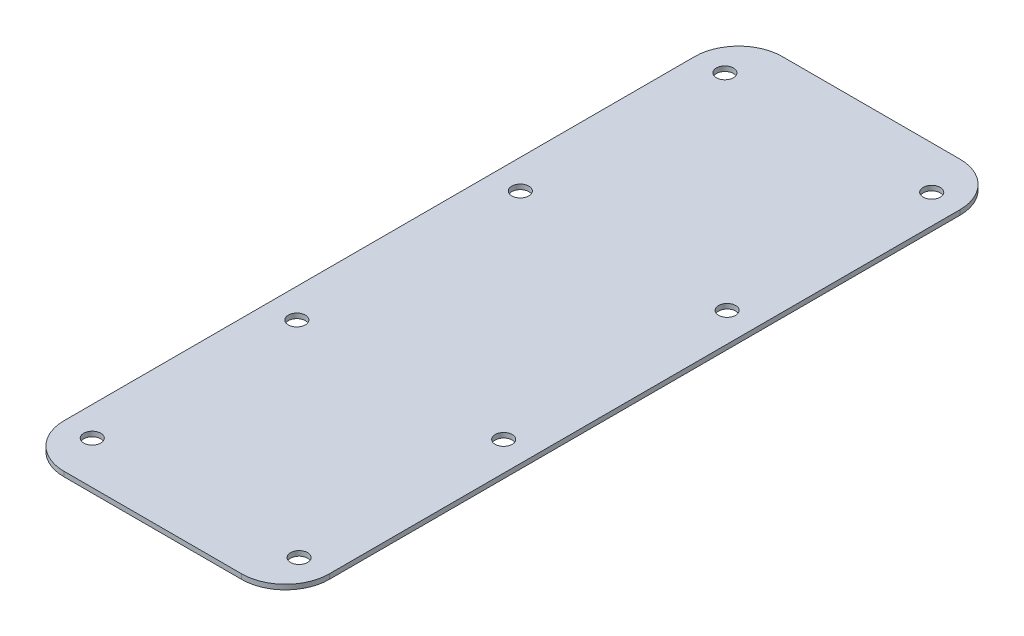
SolidWorks part; units mm, degrees
ref_plane "Front Plane" through (0, 0, 0) normal (0, 0, 1) x (1, 0, 0)
ref_plane "Top Plane" through (0, 0, 0) normal (0, 1, 0) x (1, 0, 0)
ref_plane "Right Plane" through (0, 0, 0) normal (1, 0, 0) x (0, 0, -1)
sketch "sk w14x665"
  line L0 (-224.155, 274.828) -> (224.155, -274.828) construction
  point P1 (35.941, 0)
sketch_block_instance "W14x665-1"
sketch_block "W14x665" parameters "D6"=15.24, "D1"=71.882, "D2"=448.31, "D3"=549.656, "D4"=114.808, "D5"=114.808, "D7"=35.941
ref_plane "midplane" through (0, 44.45, 0) normal (0, 1, 0) x (1, 0, 0)
sketch "clearance" plane through (0, 44.45, 0) normal (0, 1, 0) x (1, 0, 0)
  line L6 (-224.155, 274.828) -> (224.155, 274.828) construction
  line L7 (-224.155, 160.02) -> (-224.155, 274.828) construction
  line L8 (-51.181, 160.02) -> (-224.155, 160.02) construction
  line L9 (-35.941, -144.78) -> (-35.941, 144.78) construction
  line L10 (35.941, 144.78) -> (35.941, -144.78) construction
  line L12 (224.155, 274.828) -> (224.155, 160.02) construction
  line L13 (51.181, -160.02) -> (224.155, -160.02) construction
  line L14 (224.155, -274.828) -> (-224.155, -274.828) construction
  line L68 (-229.235, 271.5441) -> (-220.8711, 279.908)
  line L69 (-220.8711, 279.908) -> (220.8711, 279.908)
  line L70 (220.8711, 279.908) -> (229.235, 271.5441)
  line L71 (229.235, 271.5441) -> (229.235, 163.3039)
  line L72 (229.235, 163.3039) -> (220.8711, 154.94)
  line L73 (220.8711, 154.94) -> (50.0013, 154.94)
  line L74 (50.0013, 154.94) -> (41.021, 145.9597)
  line L75 (41.021, 145.9597) -> (41.021, -145.9597)
  line L76 (41.021, -145.9597) -> (50.0013, -154.94)
  line L77 (50.0013, -154.94) -> (220.8711, -154.94)
  line L78 (220.8711, -154.94) -> (229.235, -163.3039)
  line L79 (229.235, -163.3039) -> (229.235, -271.5441)
  line L80 (229.235, -271.5441) -> (220.8711, -279.908)
  line L81 (220.8711, -279.908) -> (-220.8711, -279.908)
  line L82 (-220.8711, -279.908) -> (-229.235, -271.5441)
  line L83 (-229.235, -271.5441) -> (-229.235, -163.3039)
  line L84 (-229.235, -163.3039) -> (-220.8711, -154.94)
  line L85 (-220.8711, -154.94) -> (-50.0013, -154.94)
  line L86 (-50.0013, -154.94) -> (-41.021, -145.9597)
  line L87 (-41.021, -145.9597) -> (-41.021, 145.9597)
  line L88 (-41.021, 145.9597) -> (-50.0013, 154.94)
  line L89 (-50.0013, 154.94) -> (-220.8711, 154.94)
  line L90 (-220.8711, 154.94) -> (-229.235, 163.3039)
  line L91 (-229.235, 163.3039) -> (-229.235, 271.5441)
  dimension "D3" = 1.27
  dimension "D4" = 45
  dimension "D5" = 45
  dimension "D6" = 1.27
  dimension "D7" = 5.08
  dimension "D8" = 1.27
  dimension "D9" = 5.08
  dimension "D10" = 5.08
  dimension "D11" = 5.08
  dimension "D12" = 5.08
  dimension "D13" = 1.27
  dimension "D14" = 5.08
  dimension "D15" = 1.27
  dimension "D16" = 5.08
  dimension "D17" = 12.7
  dimension "D18" = 1.27
  dimension "D19" = 5.08
  dimension "D20" = 12.7
  dimension "D21" = 12.7
  dimension "D22" = 12.7
  dimension "D23" = 1.27
  dimension "D24" = 1.27
sketch "bolt plate boundary"
  line L7 (224.155, -274.828) -> (241.3488, -295.9087)
  line L8 (-220.8711, 279.908) -> (220.8711, 279.908) construction
  line L9 (-224.155, 274.828) -> (224.155, -274.828) construction
  line L10 (-41.021, -145.9597) -> (-41.021, 145.9597) construction
  line L11 (-224.155, 274.828) -> (-241.3488, 295.9087)
  line L12 (41.021, 145.9597) -> (41.021, -145.9597) construction
  line L15 (220.8711, -279.908) -> (-220.8711, -279.908) construction
  point P15 (0, -305.5874)
  point P16 (-66.7004, 0)
  point P17 (-308.3103, 362.8701)
  point P18 (-308.3103, 362.8701)
  point P19 (66.7004, 0)
  dimension "D1" = 27.2034
  dimension "D2" = 25.6794
  dimension "D3" = 25.6794
  dimension "D4" = 25.6794
  dimension "D5" = 25.6794
  dimension "D6" = 27.2034
sketch_block_instance "3.5in bolt-3"
sketch_block "3.5in bolt" parameters "D1"=88.9, "D2"=136.525, "D3"=6.35, "D4"=40.7227, "D5"=45, "D6"=9.525
sketch_block_instance "3.5in bolt-4"
sketch_block_instance "3.5in bolt-5"
sketch_block_instance "3.5in bolt-6"
sketch_block_instance "3.5in bolt-7"
sketch_block_instance "3.5in bolt-8"
sketch "Sketch4" plane through (0, 0, 0) normal (0, 1, 0) x (1, 0, 0)
  line L1 (-403.008, 1612.1596) -> (403.008, 1612.1596)
  line L2 (-403.008, 1612.1596) -> (-403.008, -494.9829)
  line L3 (-403.008, -494.9829) -> (403.008, -494.9829)
  line L4 (403.008, 1612.1596) -> (403.008, -494.9829)
  circle A0 centre (308.3103, -362.8701) radius 94.6977 construction
  circle A3 centre (-308.3103, 362.8701) radius 94.6977 construction
  circle A4 centre (0, -400.2851) radius 94.6977 construction
  dimension "D1" = 1612.1596
extrude "main plate" add sketch "Sketch4" along normal blind 12.7
sketch "sk bolt holes"
  line L0 (-308.3103, 1480.0468) -> (-308.3103, 754.3065) construction
  dimension "D1" = 1117.1767
sketch_block_instance "Block1-1"
sketch_block "Block1" parameters "D1"=92.075, "D2"=92.075, "D3"=92.075, "D4"=92.075, "D5"=92.075, "D6"=92.075, "D7"=92.075, "D8"=92.075, "D9"=152.4
sketch_block_instance "Block1-2"
extrude "Cut-Extrude2" [suppressed] cut sketch "sk bolt holes" along normal blind 88.9
fillet "Fillet1" radius 139.7 4 edges at (-403.008, 6.35, -1612.1596) (403.008, 6.35, -1612.1596) (403.008, 6.35, 494.9829) (-403.008, 6.35, 494.9829)
sketch "Sketch5" plane through (0, 0, 0) normal (0, 1, 0) x (1, 0, 0)
  line L0 (-263.308, 494.9829) -> (263.308, 494.9829)
  line L1 (403.008, 355.2829) -> (403.008, 178.1629) construction
  line L2 (-403.008, 355.2829) -> (-403.008, 178.1629) construction
  line L3 (-403.008, -494.9829) -> (403.008, -494.9829) construction
  line L4 (-403.008, 1612.1596) -> (-403.008, -494.9829) construction
  line L5 (403.008, 1612.1596) -> (403.008, -494.9829) construction
  line L6 (-622.6455, 355.2829) -> (-403.008, 355.2829)
  line L7 (-622.6455, 355.2829) -> (-622.6455, 1883.2722)
  line L8 (-622.6455, 1883.2722) -> (635.7396, 1883.2722)
  line L9 (635.7396, 1883.2722) -> (635.7396, 355.2829)
  line L10 (403.008, 355.2829) -> (635.7396, 355.2829)
  arc A0 (263.308, 494.9829) -> (403.008, 355.2829) centre (263.308, 355.2829) cw
  arc A1 (-263.308, 494.9829) -> (-403.008, 355.2829) centre (-263.308, 355.2829) ccw
  dimension "D2" = 139.7
  dimension "D1" = 989.9658
extrude "Cut-Extrude3" [suppressed] cut sketch "Sketch5" along normal blind 25.4
sketch "edge cut"
  dimension "D3" = 314.108
  dimension "D1" = 314.108
  dimension "D2" = 368.6679
sketch_block_instance "Block2-1"
sketch_block "Block2" parameters "D1"=63.5, "D2"=88.9, "D3"=88.9, "D4"=63.5, "D5"=36.2949, "D6"=205.9404, "D7"=205.9404, "D8"=806.016, "D9"=205.9404, "D10"=205.9404, "D11"=36.2949, "D12"=989.9658
sketch "Sketch8"
  line L9 (-403.008, 1472.4596) -> (-403.008, -355.2829) construction
  circle A9 centre (-308.3103, 1480.0468) radius 46.0375 construction
  point P22 (44.45, -494.9829)
  point P25 (-44.45, -494.9829)
  dimension "D1" = 211.947
  dimension "D2" = 88.9
sketch_block_instance "Block3-1"
sketch_block "Block3" parameters "D2"=63.5, "D1"=45
sketch_block_instance "Block3-2"
extrude "Cut-Extrude4" [suppressed] cut sketch "Sketch8" along normal blind 25.4
extrude "Cut-Extrude5" [suppressed] cut sketch "edge cut" along normal blind 25.4
sketch "Sketch9" [suppressed] plane through (0, 0, 0) normal (0, 1, 0) x (1, 0, 0)
  line L13 (-634.2758, 1741.4763) -> (575.9516, 1741.4763)
  line L14 (-634.2758, 1741.4763) -> (-634.2758, -620.6544)
  line L15 (-634.2758, -620.6544) -> (575.9516, -620.6544)
  line L16 (575.9516, 1741.4763) -> (575.9516, -620.6544)
  line L24 (108.1676, -444.8679) -> (314.108, -444.8679)
  line L25 (54.0685, -467.4039) -> (54.286, -467.1863)
  line L26 (-18.1474, -482.2829) -> (18.1474, -482.2829)
  line L27 (-54.286, -467.1863) -> (-54.0685, -467.4039)
  line L28 (-314.108, -444.8679) -> (-108.1676, -444.8679)
  line L29 (-390.308, 1472.4596) -> (-390.308, -355.2829)
  line L30 (390.308, -355.2829) -> (390.308, 1472.4596)
  line L31 (314.108, 1562.0446) -> (108.1676, 1562.0446)
  line L32 (54.286, 1584.363) -> (54.0685, 1584.5806)
  line L33 (18.1474, 1599.4596) -> (-18.1474, 1599.4596)
  line L34 (-54.0685, 1584.5806) -> (-54.286, 1584.363)
  line L35 (-108.1676, 1562.0446) -> (-314.108, 1562.0446)
  line L36 (108.1676, -444.8679) -> (314.108, -444.8679)
  line L37 (54.0685, -467.4039) -> (54.286, -467.1863)
  line L38 (-18.1474, -482.2829) -> (18.1474, -482.2829)
  line L39 (-54.286, -467.1863) -> (-54.0685, -467.4039)
  line L40 (-314.108, -444.8679) -> (-108.1676, -444.8679)
  line L41 (-390.308, 1472.4596) -> (-390.308, -355.2829)
  line L42 (390.308, -355.2829) -> (390.308, 1472.4596)
  line L43 (314.108, 1562.0446) -> (108.1676, 1562.0446)
  line L44 (54.286, 1584.363) -> (54.0685, 1584.5806)
  line L45 (18.1474, 1599.4596) -> (-18.1474, 1599.4596)
  line L46 (-54.0685, 1584.5806) -> (-54.286, 1584.363)
  line L47 (-108.1676, 1562.0446) -> (-314.108, 1562.0446)
  arc A32 (314.108, -444.8679) -> (377.3411, -411.1887) centre (314.108, -368.6679) ccw
  arc A33 (108.1676, -444.8679) -> (54.286, -467.1863) centre (108.1676, -521.0679) ccw
  arc A34 (18.1474, -482.2829) -> (54.0685, -467.4039) centre (18.1474, -431.4829) ccw
  arc A35 (-54.0685, -467.4039) -> (-18.1474, -482.2829) centre (-18.1474, -431.4829) ccw
  arc A36 (-54.286, -467.1863) -> (-108.1676, -444.8679) centre (-108.1676, -521.0679) ccw
  arc A37 (-377.3411, -411.1887) -> (-314.108, -444.8679) centre (-314.108, -368.6679) ccw
  arc A38 (-390.308, -355.2829) -> (-377.3411, -411.1887) centre (-263.308, -355.2829) ccw
  arc A39 (-377.3411, 1528.3653) -> (-390.308, 1472.4596) centre (-263.308, 1472.4596) ccw
  arc A40 (390.308, 1472.4596) -> (377.3411, 1528.3653) centre (263.308, 1472.4596) ccw
  arc A41 (377.3411, -411.1887) -> (390.308, -355.2829) centre (263.308, -355.2829) ccw
  arc A42 (-314.108, 1562.0446) -> (-377.3411, 1528.3653) centre (-314.108, 1485.8446) ccw
  arc A43 (377.3411, 1528.3653) -> (314.108, 1562.0446) centre (314.108, 1485.8446) ccw
  arc A44 (54.286, 1584.363) -> (108.1676, 1562.0446) centre (108.1676, 1638.2446) ccw
  arc A45 (54.0685, 1584.5806) -> (18.1474, 1599.4596) centre (18.1474, 1548.6596) ccw
  arc A46 (-18.1474, 1599.4596) -> (-54.0685, 1584.5806) centre (-18.1474, 1548.6596) ccw
  arc A47 (-108.1676, 1562.0446) -> (-54.286, 1584.363) centre (-108.1676, 1638.2446) ccw
  arc A48 (314.108, -444.8679) -> (377.3411, -411.1887) centre (314.108, -368.6679) ccw
  arc A49 (108.1676, -444.8679) -> (54.286, -467.1863) centre (108.1676, -521.0679) ccw
  arc A50 (18.1474, -482.2829) -> (54.0685, -467.4039) centre (18.1474, -431.4829) ccw
  arc A51 (-54.0685, -467.4039) -> (-18.1474, -482.2829) centre (-18.1474, -431.4829) ccw
  arc A52 (-54.286, -467.1863) -> (-108.1676, -444.8679) centre (-108.1676, -521.0679) ccw
  arc A53 (-377.3411, -411.1887) -> (-314.108, -444.8679) centre (-314.108, -368.6679) ccw
  arc A54 (-390.308, -355.2829) -> (-377.3411, -411.1887) centre (-263.308, -355.2829) ccw
  arc A55 (-377.3411, 1528.3653) -> (-390.308, 1472.4596) centre (-263.308, 1472.4596) ccw
  arc A56 (390.308, 1472.4596) -> (377.3411, 1528.3653) centre (263.308, 1472.4596) ccw
  arc A57 (377.3411, -411.1887) -> (390.308, -355.2829) centre (263.308, -355.2829) ccw
  arc A58 (-314.108, 1562.0446) -> (-377.3411, 1528.3653) centre (-314.108, 1485.8446) ccw
  arc A59 (377.3411, 1528.3653) -> (314.108, 1562.0446) centre (314.108, 1485.8446) ccw
  arc A60 (54.286, 1584.363) -> (108.1676, 1562.0446) centre (108.1676, 1638.2446) ccw
  arc A61 (54.0685, 1584.5806) -> (18.1474, 1599.4596) centre (18.1474, 1548.6596) ccw
  arc A62 (-18.1474, 1599.4596) -> (-54.0685, 1584.5806) centre (-18.1474, 1548.6596) ccw
  arc A63 (-108.1676, 1562.0446) -> (-54.286, 1584.363) centre (-108.1676, 1638.2446) ccw
  dimension "D1" = 12.7
extrude "Cut-Extrude6" [suppressed] cut sketch "Sketch9" along normal blind 12.7
sketch "Sketch10"
  circle A0 centre (-308.3103, 1480.0468) radius 46.0375 construction
  circle A1 centre (308.3103, 1480.0468) radius 46.0375 construction
  circle A2 centre (0, 1517.4618) radius 46.0375 construction
  circle A3 centre (-161.3981, 1117.1767) radius 46.0375 construction
  circle A4 centre (161.3981, 1117.1767) radius 46.0375 construction
  circle A5 centre (-308.3103, 754.3065) radius 46.0375 construction
  circle A6 centre (0, 716.8915) radius 46.0375 construction
  circle A7 centre (308.3103, 754.3065) radius 46.0375 construction
  circle A8 centre (-308.3103, 362.8701) radius 46.0375 construction
  circle A9 centre (0, 400.2851) radius 46.0375 construction
  circle A10 centre (308.3103, 362.8701) radius 46.0375 construction
  circle A11 centre (-161.3981, 0) radius 46.0375 construction
  circle A12 centre (161.3981, 0) radius 46.0375 construction
  circle A13 centre (-308.3103, -362.8701) radius 46.0375 construction
  circle A14 centre (0, -400.2851) radius 46.0375 construction
  circle A15 centre (308.3103, -362.8701) radius 46.0375 construction
sketch_block_instance "Block4-1"
sketch_block "Block4" parameters "D1"=71.4375, "D2"=93.98
sketch_block_instance "Block4-2"
sketch_block_instance "Block4-3"
sketch_block_instance "Block4-4"
sketch_block_instance "Block4-5"
sketch_block_instance "Block4-6"
sketch_block_instance "Block4-7"
sketch_block_instance "Block4-8"
sketch_block_instance "Block4-9"
sketch_block_instance "Block4-10"
sketch_block_instance "Block4-11"
sketch_block_instance "Block4-12"
sketch_block_instance "Block4-13"
sketch_block_instance "Block4-14"
sketch_block_instance "Block4-15"
sketch_block_instance "Block4-16"
extrude "Boss-Extrude1" [suppressed] add sketch "Sketch10" along normal blind 12.7
sketch "Sketch11"
  line L0 (-284.2097, 1429.1359) -> (284.2097, 805.2175) construction
  line L1 (284.2097, 805.2175) -> (-284.2097, 805.2175) construction
  line L3 (-284.2097, 311.9592) -> (284.2097, -311.9592) construction
  line L4 (284.2097, -311.9592) -> (-284.2097, -311.9592) construction
  point P2 (0, 1117.1767)
  point P7 (0, 0)
sketch_block_instance "Block5-1"
sketch_block "Block5" parameters "D1"=65.0875, "D2"=65.0875, "D3"=65.0875, "D4"=65.0875, "D5"=65.0875, "D6"=65.0875, "D7"=65.0875, "D8"=65.0875
sketch_block_instance "Block5-2"
sketch "mounting plates"
  line L0 (-246.1097, 309.4192) -> (246.1097, -309.4192)
  line L9 (-246.1097, 1426.5959) -> (246.1097, 807.7575)
  point P4 (0, 1117.1767)
  point P5 (0, 0)
sketch_block_instance "Block6-1"
sketch_block "Block6" parameters "D1"=114.3, "D2"=720.8194, "D3"=847.4384
sketch_block_instance "Block6-3"
sketch "Sketch13" plane through (0, 0, 0) normal (0, 1, 0) x (1, 0, 0)
  line L0 (-360.4097, 309.4192) -> (-360.4097, -309.4192) construction
  line L1 (-246.1097, 1540.8959) -> (246.1097, 1540.8959)
  line L2 (-360.4097, 1426.5959) -> (-360.4097, -309.4192)
  line L3 (-246.1097, -423.7192) -> (246.1097, -423.7192)
  line L4 (360.4097, 1426.5959) -> (360.4097, -309.4192)
  line L5 (360.4097, 309.4192) -> (360.4097, -309.4192) construction
  line L6 (-246.1097, -423.7192) -> (246.1097, -423.7192) construction
  line L7 (-246.1097, 1540.8959) -> (246.1097, 1540.8959) construction
  line L9 (-489.1351, 1713.0375) -> (523.6166, 1713.0375)
  line L10 (-489.1351, 1713.0375) -> (-489.1351, -585.6146)
  line L11 (-489.1351, -585.6146) -> (523.6166, -585.6146)
  line L12 (523.6166, 1713.0375) -> (523.6166, -585.6146)
  arc A0 (246.1097, -423.7192) -> (360.4097, -309.4192) centre (246.1097, -309.4192) ccw
  arc A1 (-360.4097, -309.4192) -> (-246.1097, -423.7192) centre (-246.1097, -309.4192) ccw
  arc A2 (246.1097, 1540.8959) -> (360.4097, 1426.5959) centre (246.1097, 1426.5959) cw
  arc A3 (-246.1097, 1540.8959) -> (-360.4097, 1426.5959) centre (-246.1097, 1426.5959) ccw
  dimension "D1" = 114.3
extrude "Cut-Extrude7" [suppressed] cut sketch "Sketch11" along normal through all
extrude "Cut-Extrude8" [suppressed] cut sketch "Sketch13" along normal through all
sketch "Sketch14"
  line L0 (-279.6377, 297.9892) -> (279.6377, -297.9892) construction
  line L1 (279.6377, -297.9892) -> (-279.6377, -297.9892) construction
  line L2 (-279.6377, 1415.1659) -> (279.6377, 819.1875) construction
  line L3 (279.6377, 819.1875) -> (-279.6377, 819.1875) construction
  point P2 (0, 0)
  point P6 (0, 1117.1767)
sketch_block_instance "Block7-1"
sketch_block "Block7"
sketch_block_instance "Block7-2"
sketch "Sketch15"
  line L0 (-241.5377, 295.4492) -> (241.5377, -295.4492)
  line L1 (-241.5377, 1412.6259) -> (241.5377, 821.7275)
  point P2 (0, 0)
  point P5 (0, 1117.1767)
sketch_block_instance "Block8-1"
sketch_block "Block8" parameters "D1"=114.3
sketch_block_instance "Block8-2"
sketch "Sketch16" plane through (0, 0, 0) normal (0, 1, 0) x (1, 0, 0)
  line L0 (-241.5377, -409.7492) -> (241.5377, -409.7492) construction
  line L1 (-241.5377, 1526.9259) -> (241.5377, 1526.9259)
  line L2 (-355.8377, 1412.6259) -> (-355.8377, -295.4492)
  line L3 (-241.5377, -409.7492) -> (241.5377, -409.7492)
  line L4 (355.8377, 1412.6259) -> (355.8377, -295.4492)
  line L5 (-355.8377, 295.4492) -> (-355.8377, -295.4492) construction
  line L6 (355.8377, 295.4492) -> (355.8377, -295.4492) construction
  line L7 (-241.5377, 1526.9259) -> (241.5377, 1526.9259) construction
  line L9 (-577.8145, 1727.9596) -> (589.0327, 1727.9596)
  line L10 (-577.8145, 1727.9596) -> (-577.8145, -670.3603)
  line L11 (-577.8145, -670.3603) -> (589.0327, -670.3603)
  line L12 (589.0327, 1727.9596) -> (589.0327, -670.3603)
  arc A0 (241.5377, -409.7492) -> (355.8377, -295.4492) centre (241.5377, -295.4492) ccw
  arc A1 (-355.8377, -295.4492) -> (-241.5377, -409.7492) centre (-241.5377, -295.4492) ccw
  arc A2 (241.5377, 1526.9259) -> (355.8377, 1412.6259) centre (241.5377, 1412.6259) cw
  arc A3 (-241.5377, 1526.9259) -> (-355.8377, 1412.6259) centre (-241.5377, 1412.6259) ccw
  dimension "D1" = 114.3
extrude "Cut-Extrude9" [suppressed] cut sketch "Sketch14" along normal through all
extrude "Cut-Extrude10" [suppressed] cut sketch "Sketch16" along normal through all
sketch "Sketch17"
sketch_block_instance "Block9-1"
sketch_block "Block9" parameters "D1"=46.0375, "D2"=46.0375, "D3"=46.0375, "D4"=46.0375, "D5"=46.0375, "D6"=46.0375, "D7"=46.0375, "D8"=46.0375
sketch_block_instance "Block9-2"
sketch "Sketch18"
sketch_block_instance "Block10-1"
sketch_block "Block10"
sketch_block_instance "Block10-2"
sketch "Sketch19" plane through (0, 0, 0) normal (0, 1, 0) x (1, 0, 0)
  line L0 (-351.2022, 280.4632) -> (-351.2022, -280.4632) construction
  line L1 (-236.9022, 1511.9399) -> (236.9022, 1511.9399)
  line L2 (-351.2022, 1397.6399) -> (-351.2022, -280.4632)
  line L3 (-236.9022, -394.7632) -> (236.9022, -394.7632)
  line L4 (351.2022, 1397.6399) -> (351.2022, -280.4632)
  line L5 (351.2022, 280.4632) -> (351.2022, -280.4632) construction
  line L6 (-236.9022, -394.7632) -> (236.9022, -394.7632) construction
  line L7 (-236.9022, 1511.9399) -> (236.9022, 1511.9399) construction
  line L9 (-532.9312, 1680.24) -> (547.7827, 1680.24)
  line L10 (-532.9312, 1680.24) -> (-532.9312, -577.9182)
  line L11 (-532.9312, -577.9182) -> (547.7827, -577.9182)
  line L12 (547.7827, 1680.24) -> (547.7827, -577.9182)
  arc A0 (236.9022, -394.7632) -> (351.2022, -280.4632) centre (236.9022, -280.4632) ccw
  arc A1 (-351.2022, -280.4632) -> (-236.9022, -394.7632) centre (-236.9022, -280.4632) ccw
  arc A2 (236.9022, 1511.9399) -> (351.2022, 1397.6399) centre (236.9022, 1397.6399) cw
  arc A3 (-236.9022, 1511.9399) -> (-351.2022, 1397.6399) centre (-236.9022, 1397.6399) ccw
  dimension "D1" = 114.3
extrude "Cut-Extrude11" [suppressed] cut sketch "Sketch17" along normal through all
extrude "Cut-Extrude12" [suppressed] cut sketch "Sketch19" along normal through all
sketch "Sketch20"
sketch_block_instance "Block13-1"
sketch_block "Block13" parameters "D1"=52.3875, "D2"=52.3875, "D3"=52.3875, "D4"=52.3875, "D5"=52.3875, "D6"=52.3875, "D7"=52.3875, "D8"=52.3875
sketch_block_instance "Block13-2"
sketch "Sketch21"
sketch_block_instance "Block14-1"
sketch_block "Block14"
sketch_block_instance "Block14-2"
sketch "Sketch22" plane through (0, 0, 0) normal (0, 1, 0) x (1, 0, 0)
  line L9 (-566.9915, 1680.6189) -> (520.1683, 1680.6189)
  line L10 (-566.9915, 1680.6189) -> (-566.9915, -611.8702)
  line L11 (-566.9915, -611.8702) -> (520.1683, -611.8702)
  line L12 (520.1683, 1680.6189) -> (520.1683, -611.8702)
  line L14 (-346.1222, 1381.6379) -> (-346.1222, 852.7155) construction
  line L15 (-231.8222, 1495.9379) -> (231.8222, 1495.9379)
  line L16 (-346.1222, 1381.6379) -> (-346.1222, -264.4612)
  line L17 (-231.8222, -378.7612) -> (231.8222, -378.7612)
  line L18 (346.1222, 1381.6379) -> (346.1222, -264.4612)
  line L19 (346.1222, 1381.6379) -> (346.1222, 852.7155) construction
  line L20 (-231.8222, 1495.9379) -> (231.8222, 1495.9379) construction
  line L21 (-231.8222, -378.7612) -> (231.8222, -378.7612) construction
  arc A4 (-346.1222, -264.4612) -> (-231.8222, -378.7612) centre (-231.8222, -264.4612) ccw
  arc A5 (231.8222, -378.7612) -> (346.1222, -264.4612) centre (231.8222, -264.4612) ccw
  arc A6 (231.8222, 1495.9379) -> (346.1222, 1381.6379) centre (231.8222, 1381.6379) cw
  arc A7 (-231.8222, 1495.9379) -> (-346.1222, 1381.6379) centre (-231.8222, 1381.6379) ccw
  dimension "D1" = 114.3
extrude "Cut-Extrude13" cut sketch "Sketch20" along normal through all
extrude "Cut-Extrude14" cut sketch "Sketch22" along normal through all
sketch "Sketch23"
  circle A0 centre (-269.9222, -267.0012) radius 26.1938 construction
  circle A1 centre (-269.9222, 267.0012) radius 26.1937 construction
  circle A2 centre (-269.9222, 850.1755) radius 26.1938 construction
  circle A3 centre (269.9222, 850.1755) radius 26.1938 construction
  circle A4 centre (269.9222, 267.0012) radius 26.1938 construction
  circle A5 centre (269.9222, -267.0012) radius 26.1938 construction
  circle A6 centre (-269.9222, 1384.1779) radius 26.1938 construction
  circle A7 centre (269.9222, 1384.1779) radius 26.1938 construction
  point P0 (-369.8826, 1376.6662)
sketch_block_instance "Block15-1"
sketch_block "Block15" parameters "D1"=44.45, "D2"=63.5
sketch_block_instance "Block15-2"
sketch_block_instance "Block15-3"
sketch_block_instance "Block15-4"
sketch_block_instance "Block15-5"
sketch_block_instance "Block15-6"
sketch_block_instance "Block15-7"
sketch_block_instance "Block15-8"
extrude "Boss-Extrude2" add sketch "Sketch23" along normal up to surface (12.7 mm away)
